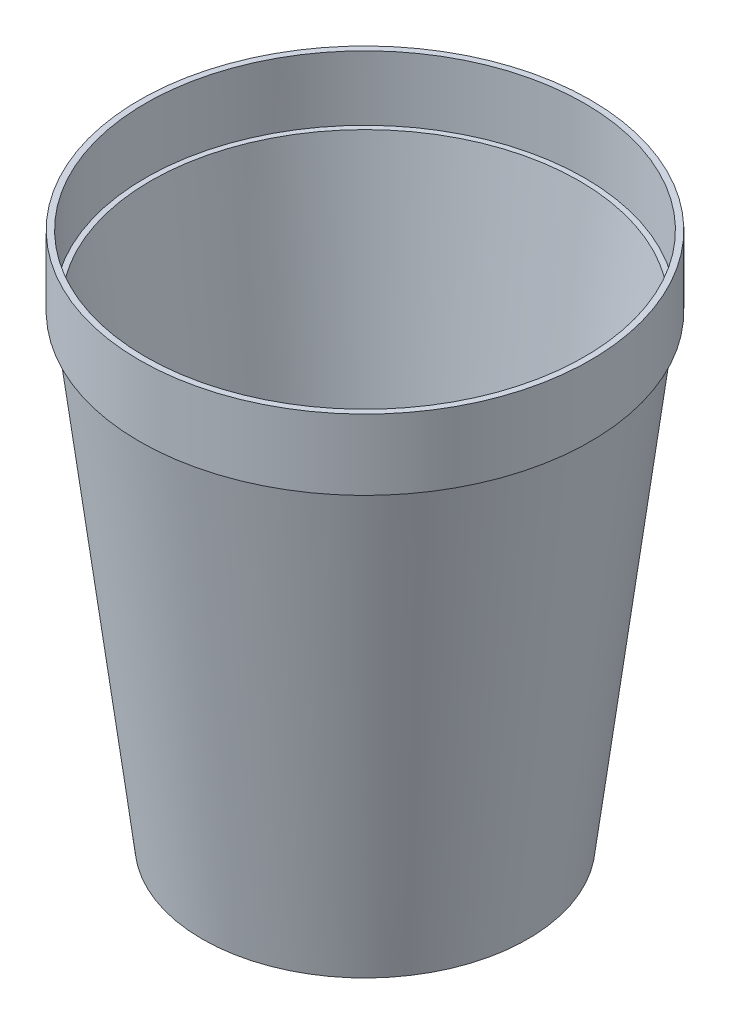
SolidWorks part; units mm, degrees
ref_plane "Front Plane" through (0, 0, 0) normal (0, 0, 1) x (1, 0, 0)
ref_plane "Top Plane" through (0, 0, 0) normal (0, 1, 0) x (1, 0, 0)
ref_plane "Right Plane" through (0, 0, 0) normal (1, 0, 0) x (0, 0, -1)
sketch "Sketch1" plane through (0, 0, 0) normal (0, 1, 0) x (1, 0, 0)
  line L1 (0, 0) -> (1200, 0) construction
  line L2 (0, 0) -> (0, 765) construction
  line L3 (0, 765) -> (1200, 765) construction
  line L4 (1200, 0) -> (1200, 765) construction
  dimension "D1" = 1200
  dimension "D2" = 765
sketch "Sketch3" plane through (0, 0, 0) normal (0, 0, 1) x (1, 0, 0)
  line L0 (0, 0) -> (0, 180)
  line L1 (0, 180) -> (76.1785, 180)
  line L2 (76.1785, 180) -> (76.1785, 156.1964)
  line L3 (76.1785, 156.1964) -> (74.1785, 156.1964)
  line L4 (74.1785, 156.1964) -> (55, 0)
  line L5 (0, 0) -> (1200, 0) construction
  line L6 (55, 0) -> (0, 0)
  dimension "D1" = 55
  dimension "D2" = 97
  dimension "D3" = 2
  dimension "D4" = 180
  dimension "D5" = 23.8036
revolve "Revolve1" add sketch "Sketch3" angle 360 about L0
shell "Shell1" thickness 2
